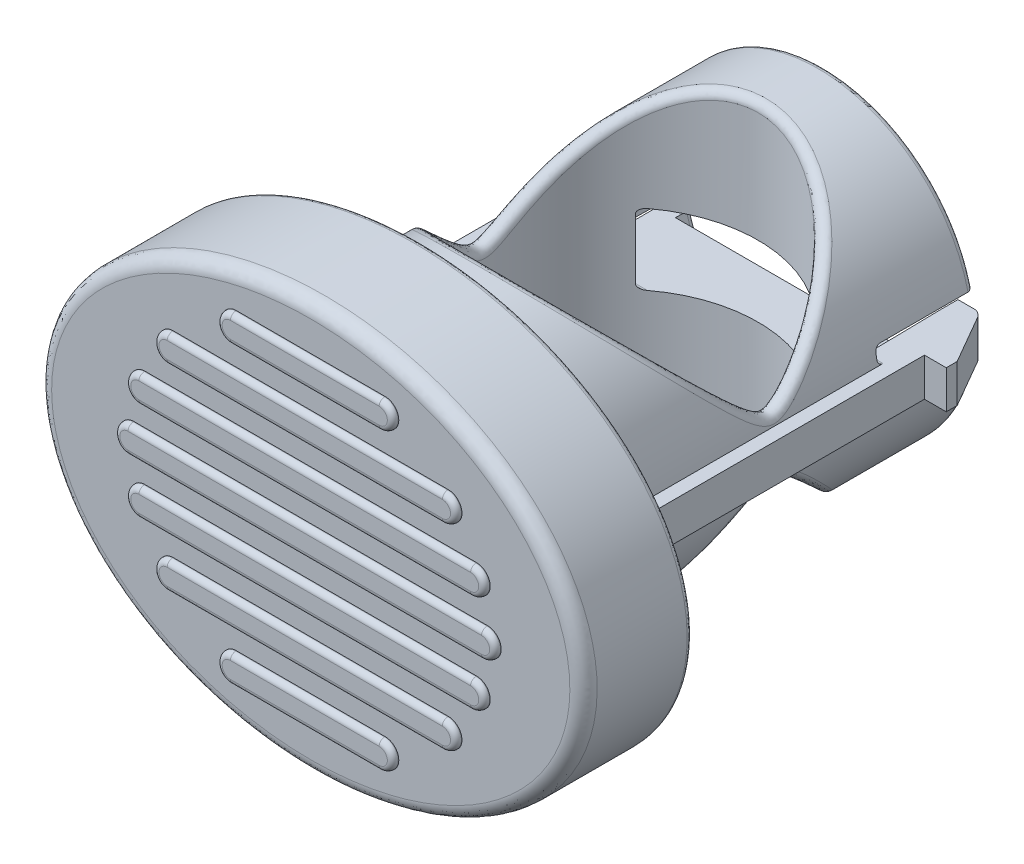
SolidWorks part; units mm, degrees
ref_plane "Front" through (0, 0, 0) normal (0, 0, 1) x (1, 0, 0)
ref_plane "Top" through (0, 0, 0) normal (0, 1, 0) x (1, 0, 0)
ref_plane "Right" through (0, 0, 0) normal (1, 0, 0) x (0, 0, -1)
sketch "Sketch1" plane through (0, 0, 0) normal (0, 0, 1) x (1, 0, 0)
  circle A0 centre (0, 0) radius 7.1755
  dimension "D1" = 14.351
extrude "Extrude1" add sketch "Sketch1" against normal blind 18.796
sketch "Sketch2" plane through (0, 0, 0) normal (0, 0, 1) x (1, 0, 0)
  ellipse E0 centre (0, 0) end of major axis (-12.7, 0) minor radius 9.525
  dimension "D1" = 19.05
  dimension "D2" = 25.4
extrude "Extrude2" add sketch "Sketch2" along normal blind 5.08
sketch "Sketch3" plane through (0, 0, 0) normal (0, 1, 0) x (1, 0, 0)
  line L0 (6.985, 18.796) -> (7.2965, 18.796)
  line L1 (7.1755, 18.796) -> (-7.1755, 18.796) construction
  line L2 (8.763, 16.256) -> (8.763, 15.748)
  line L3 (8.763, 15.748) -> (7.747, 15.748)
  line L4 (7.747, 15.748) -> (7.747, 0)
  line L5 (8.763, 16.256) -> (7.2965, 18.796)
  line L6 (12.7, 0) -> (-12.7, 0) construction
  line L7 (7.747, 0) -> (6.985, 0)
  line L8 (6.985, 0) -> (6.985, 18.796)
  line L9 (0, 0) -> (0, 6.651) construction
  line L10 (-6.985, 0) -> (-6.985, 18.796)
  line L11 (-7.747, 0) -> (-6.985, 0)
  line L12 (-8.763, 16.256) -> (-7.2965, 18.796)
  line L13 (-7.747, 15.748) -> (-7.747, 0)
  line L14 (-8.763, 15.748) -> (-7.747, 15.748)
  line L15 (-8.763, 16.256) -> (-8.763, 15.748)
  line L16 (-6.985, 18.796) -> (-7.2965, 18.796)
  dimension "D1" = 30
  dimension "D2" = 6.985
  dimension "D3" = 1.778
  dimension "D4" = 0.762
  dimension "D5" = 0.508
  dimension "D6" = 3.048
extrude "Extrude3" add sketch "Sketch3" along normal mid plane 1.778
sketch "Sketch4" plane through (0, 0, 0) normal (0, 1, 0) x (1, 0, 0)
  line L1 (0, 0) -> (0, 18.796) construction
  line L2 (7.1202, 0) -> (-7.1202, 0) construction
  line L3 (7.1202, 18.796) -> (-7.1202, 18.796) construction
  circle A0 centre (0, 9.398) radius 6.35
  dimension "D1" = 12.7
extrude "Cut-Extrude1" cut sketch "Sketch4" against normal through all and the other way through all
fillet "Fillet1" radius 0.635 3 edges at (-7.2965, 0, -18.796) (7.2965, 0, -18.796) (-12.7, 0, 5.08)
fillet "Fillet10" radius 0.381 2 edges at (0.5926, -7.151, -15.7203) (-0.5926, 7.151, -15.7203)
sketch "Sketch5" plane through (0, 0, -18.796) normal (0, 0, -1) x (-1, 0, 0)
  circle A0 centre (0, 0) radius 6.35
  dimension "D1" = 12.7
extrude "Cut-Extrude2" cut sketch "Sketch5" against normal blind 0.762
sketch "Sketch6" plane through (5.7459, -1.8864, 5.08) normal (0, 0, 1) x (1, 0, 0)
  line L0 (-5.7459, 1.8864) -> (-14.3394, 1.8864) construction
  line L1 (-9.21, 9.3794) -> (-2.2818, 9.3794)
  line L2 (-13.4668, 0.2354) -> (1.975, 0.2354)
  line L3 (-9.21, 8.1094) -> (-2.2818, 8.1094)
  line L4 (-13.4668, -1.0346) -> (1.975, -1.0346)
  line L5 (-12.1515, 7.0934) -> (0.6597, 7.0934)
  line L6 (-12.1515, -2.0506) -> (0.6597, -2.0506)
  line L7 (-12.1515, 5.8234) -> (0.6597, 5.8234)
  line L8 (-12.1515, -3.3206) -> (0.6597, -3.3206)
  line L9 (-13.4668, 4.8074) -> (1.975, 4.8074)
  line L10 (-9.21, -4.3366) -> (-2.2818, -4.3366)
  line L11 (-13.4668, 3.5374) -> (1.975, 3.5374)
  line L12 (-9.21, -5.6066) -> (-2.2818, -5.6066)
  line L13 (-13.9764, 2.5214) -> (2.4847, 2.5214)
  line L15 (-13.9764, 1.2514) -> (2.4847, 1.2514)
  circle A0 centre (-5.7459, 1.8864) radius 8.255 construction
  arc A1 (-2.2818, 9.3794) -> (-2.2818, 8.1094) centre (-2.2818, 8.7444) cw
  arc A2 (0.6597, 7.0934) -> (0.6597, 5.8234) centre (0.6597, 6.4584) cw
  arc A3 (1.975, 4.8074) -> (1.975, 3.5374) centre (1.975, 4.1724) cw
  arc A4 (2.4847, 2.5214) -> (2.4847, 1.2514) centre (2.4847, 1.8864) cw
  arc A5 (-9.21, 9.3794) -> (-9.21, 8.1094) centre (-9.21, 8.7444) ccw
  arc A6 (-12.1515, 7.0934) -> (-12.1515, 5.8234) centre (-12.1515, 6.4584) ccw
  arc A7 (-13.4668, 4.8074) -> (-13.4668, 3.5374) centre (-13.4668, 4.1724) ccw
  arc A8 (-13.9764, 2.5214) -> (-13.9764, 1.2514) centre (-13.9764, 1.8864) ccw
  arc A9 (-13.4668, -1.0346) -> (-13.4668, 0.2354) centre (-13.4668, -0.3996) cw
  arc A10 (-12.1515, -3.3206) -> (-12.1515, -2.0506) centre (-12.1515, -2.6856) cw
  arc A11 (-9.21, -5.6066) -> (-9.21, -4.3366) centre (-9.21, -4.9716) cw
  arc A12 (1.975, -1.0346) -> (1.975, 0.2354) centre (1.975, -0.3996) ccw
  arc A13 (0.6597, -3.3206) -> (0.6597, -2.0506) centre (0.6597, -2.6856) ccw
  arc A14 (-2.2818, -5.6066) -> (-2.2818, -4.3366) centre (-2.2818, -4.9716) ccw
  dimension "D5" = 16.51
  dimension "D1" = 1.016
  dimension "D2" = 1.016
  dimension "D3" = 1.016
  dimension "D4" = 1.27
extrude "Extrude4" add sketch "Sketch6" along normal blind 0.2794
sketch "Sketch7" plane through (0, 0, 0) normal (1, 0, 0) x (0, 0, -1)
  line L0 (18.796, 0) -> (0, 0) construction
  line L1 (18.796, 1.8612) -> (18.796, -1.8612) construction
  line L2 (18.7668, 0.889) -> (18.7668, -0.889)
  line L3 (18.7668, 0.889) -> (14.1948, 0.889)
  line L4 (19.2748, 1.651) -> (19.2748, -1.651)
  line L5 (19.2748, 1.651) -> (14.1948, 1.651)
  line L6 (14.1948, 1.651) -> (14.1948, 0.889)
  line L7 (18.7668, -0.889) -> (14.1948, -0.889)
  line L8 (14.1948, -0.889) -> (14.1948, -1.651)
  line L9 (19.2748, -1.651) -> (14.1948, -1.651)
  dimension "D1" = 0.762
  dimension "D2" = 5.08
  dimension "D4" = 0.508
extrude "Cut-Extrude3" cut sketch "Sketch7" against normal through all and the other way through all
sketch "Sketch8" plane through (0, 0, -18.034) normal (0, 0, -1) x (-1, 0, 0)
  line L1 (-6.2875, 0.889) -> (6.2875, 0.889)
  line L3 (-6.2875, -0.889) -> (6.2875, -0.889)
  arc A1 (-6.2875, 0.889) -> (-6.2875, -0.889) centre (0, 0) ccw
  arc A2 (6.2875, -0.889) -> (6.2875, 0.889) centre (0, 0) ccw construction
  arc A3 (6.2875, -0.889) -> (6.2875, 0.889) centre (0, 0) ccw
  arc A4 (-6.2875, 0.889) -> (-6.2875, -0.889) centre (0, 0) ccw construction
extrude "Cut-Extrude4" cut sketch "Sketch8" against normal up to vertex draft 1
fillet "Fillet11" radius 0.254 45 edges at (-4.0991, 6.858, 5.3594) (0, 7.493, 5.3594) (4.0991, 6.858, 5.3594) (-7.0406, 4.572, 5.3594) (0, 5.207, 5.3594) (7.0406, 4.572, 5.3594) (-8.3559, 2.286, 5.3594) (0, 2.921, 5.3594) (8.3559, 2.286, 5.3594) (-8.8655, 0, 5.3594) (0, 0.635, 5.3594) (8.8655, 0, 5.3594) (-8.3559, -2.286, 5.3594) (0, -1.651, 5.3594) (8.3559, -2.286, 5.3594) (-7.0406, -4.572, 5.3594) (0, -3.937, 5.3594) (7.0406, -4.572, 5.3594) (-4.0991, -6.858, 5.3594) (0, -6.223, 5.3594) (4.0991, -6.858, 5.3594) (0, 6.223, 5.3594) (0, 3.937, 5.3594) (0, 1.651, 5.3594) (0, -0.635, 5.3594) (0, -2.921, 5.3594) (0, -5.207, 5.3594) (0, -7.493, 5.3594) (-12.7, 0, 0) (6.5308, -1.651, -18.796) (6.5308, 1.651, -18.796) (-6.5308, 1.651, -18.796) (-6.5308, -1.651, -18.796) (0, 7.1755, -18.796) (0, -7.1755, -18.796) (-5.5719, 1.651, -14.1948) (5.5719, 1.651, -14.1948) (6.7377, -0.889, -14.1948) (6.7377, 0.889, -14.1948) (5.5719, -1.651, -14.1948) (-5.5719, -1.651, -14.1948) (-6.7377, -0.889, -14.1948) (-6.7377, 0.889, -14.1948) (0, -6.35, -18.796) (0, 6.35, -18.796)
